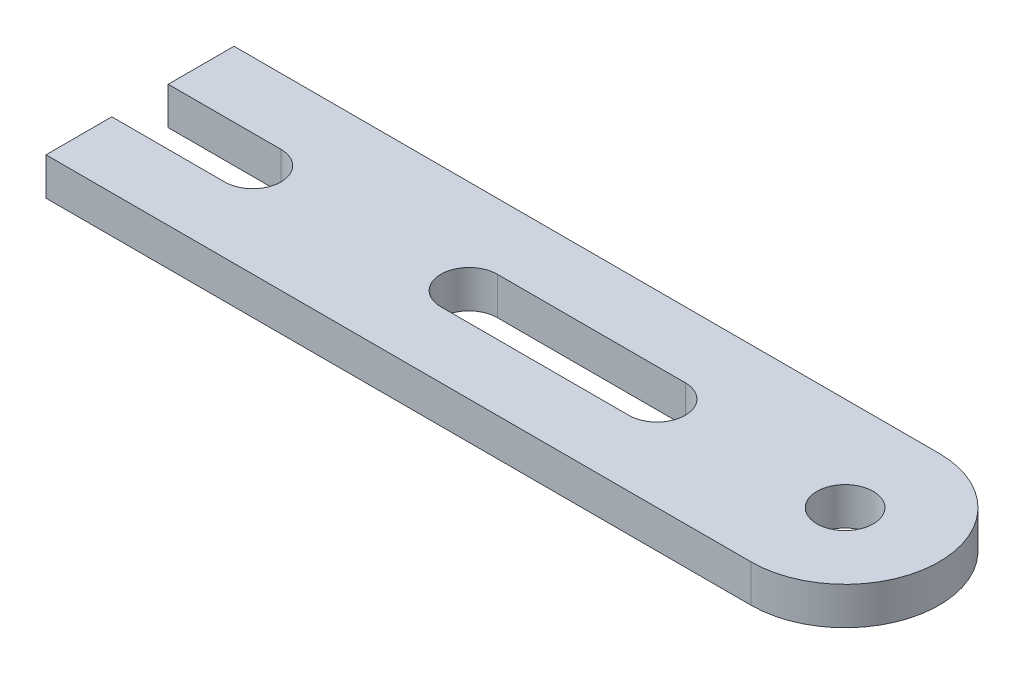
SolidWorks part; units mm, degrees
ref_plane "Front Plane" through (0, 0, 0) normal (0, 0, 1) x (1, 0, 0)
ref_plane "Top Plane" through (0, 0, 0) normal (0, 1, 0) x (1, 0, 0)
ref_plane "Right Plane" through (0, 0, 0) normal (1, 0, 0) x (0, 0, -1)
sketch "Sketch1" plane through (0, 0, 0) normal (0, 1, 0) x (1, 0, 0)
  line L1 (0, 0) -> (90, 0)
  line L2 (0, 0) -> (0, 20)
  line L3 (0, 20) -> (90, 20)
  line L4 (90, 0) -> (90, 20)
  dimension "D1" = 90
  dimension "D2" = 20
extrude "Extrude1" add sketch "Sketch1" along normal blind 4
sketch "Sketch2" plane through (0, 4, 0) normal (0, 1, 0) x (1, 0, 0)
  line L0 (0, 10) -> (90, 10) construction
  line L1 (0, 20) -> (0, 0) construction
  line L2 (90, 0) -> (90, 20) construction
  line L3 (35, 10) -> (55, 10) construction
  line L4 (35, 13) -> (55, 13)
  line L5 (35, 7) -> (55, 7)
  line L6 (12, 13) -> (0, 13)
  line L7 (12, 7) -> (0, 7)
  line L8 (0, 7) -> (0, 13)
  line L9 (75, 20) -> (90, 20)
  line L10 (90, 20) -> (90, 0)
  line L11 (90, 0) -> (75, 0)
  circle A0 centre (75, 10) radius 3
  arc A1 (12, 7) -> (12, 13) centre (12, 10) ccw
  arc A2 (35, 13) -> (35, 7) centre (35, 10) ccw
  arc A3 (55, 7) -> (55, 13) centre (55, 10) ccw
  arc A4 (75, 0) -> (75, 20) centre (75, 10) ccw
  point P12 (45, 10)
  dimension "D2" = 23
  dimension "D3" = 20
  dimension "D4" = 20
  dimension "D5" = 6
  dimension "D6" = 3
  dimension "D7" = 6
  dimension "D1" = 12
extrude "Cut-Extrude1" cut sketch "Sketch2" against normal through all
